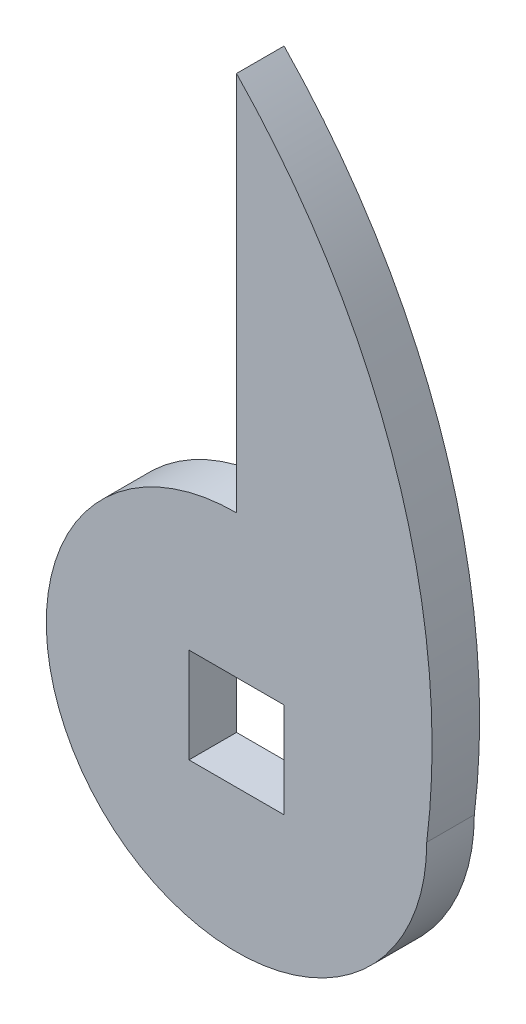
SolidWorks part; units mm, degrees
ref_plane "Front Plane" through (0, 0, 0) normal (0, 0, 1) x (1, 0, 0)
ref_plane "Top Plane" through (0, 0, 0) normal (0, 1, 0) x (1, 0, 0)
ref_plane "Right Plane" through (0, 0, 0) normal (1, 0, 0) x (0, 0, -1)
sketch "Sketch1" plane through (0, 0, 0) normal (0, 0, 1) x (1, 0, 0)
  line L0 (-27.8411, 19.8484) -> (-27.8411, 45.2484)
  line L2 (-31.0161, 3.9734) -> (-24.6661, 3.9734)
  line L3 (-31.0161, 3.9734) -> (-31.0161, 10.3234)
  line L4 (-31.0161, 10.3234) -> (-24.6661, 10.3234)
  line L5 (-24.6661, 3.9734) -> (-24.6661, 10.3234)
  line L6 (-31.0161, 3.9734) -> (-24.6661, 10.3234) construction
  line L7 (-31.0161, 10.3234) -> (-24.6661, 3.9734) construction
  arc A0 (-27.8411, 19.8484) -> (-15.1411, 7.1484) centre (-27.8411, 7.1484) ccw
  arc A1 (-27.8411, 45.2484) -> (-15.1411, 7.1484) centre (-61.3877, 12.8995) cw
  dimension "D1" = 25.4
  dimension "D2" = 25.4
  dimension "D3" = 6.35
  dimension "D4" = 6.35
extrude "Boss-Extrude1" add sketch "Sketch1" along normal blind 3.175
